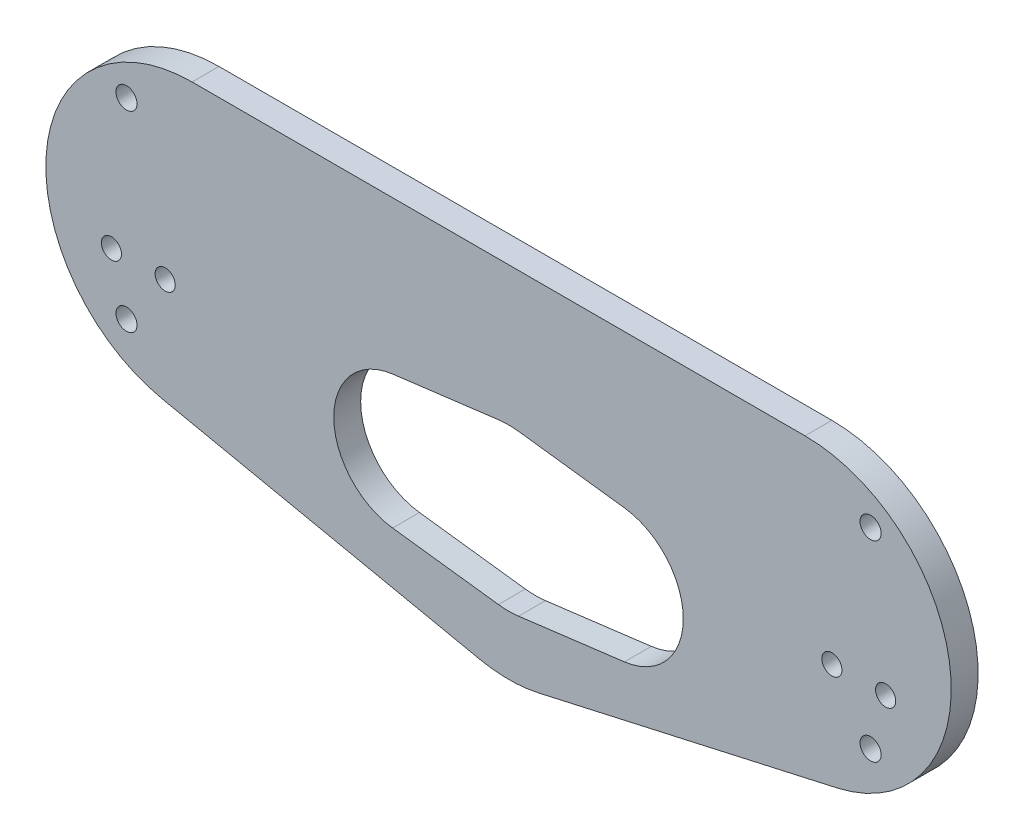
SolidWorks part; units mm, degrees
ref_plane "Front Plane" through (0, 0, 0) normal (0, 0, 1) x (1, 0, 0)
ref_plane "Top Plane" through (0, 0, 0) normal (0, 1, 0) x (1, 0, 0)
ref_plane "Right Plane" through (0, 0, 0) normal (1, 0, 0) x (0, 0, -1)
sketch "Sketch1" plane through (0, 0, 0) normal (0, 0, 1) x (1, 0, 0)
  line L3 (66.04, 34.544) -> (-78.74, 34.544)
  line L4 (-85.8469, -33.805) -> (-10.7844, -49.5856)
  line L5 (3.2368, -49.4912) -> (73.6014, -33.7063)
  line L6 (66.04, 34.544) -> (-78.74, 34.544)
  line L7 (-85.8469, -33.805) -> (-10.7844, -49.5856)
  line L8 (3.2368, -49.4912) -> (73.6014, -33.7063)
  circle A0 centre (-94.234, -21.721) radius 2.4892 construction
  circle A1 centre (-97.79, -9.021) radius 2.3813 construction
  circle A2 centre (-85.09, -9.021) radius 2.3813 construction
  arc A3 (73.6014, -33.7063) -> (66.04, 34.544) centre (66.04, 0) ccw
  arc A4 (-78.74, 34.544) -> (-85.8469, -33.805) centre (-78.74, 0) ccw
  arc A5 (-10.7844, -49.5856) -> (3.2368, -49.4912) centre (-3.991, -17.272) ccw
  arc A6 (73.6014, -33.7063) -> (66.04, 34.544) centre (66.04, 0) ccw
  arc A7 (-78.74, 34.544) -> (-85.8469, -33.805) centre (-78.74, 0) ccw
  arc A8 (-10.7844, -49.5856) -> (3.2368, -49.4912) centre (-3.991, -17.272) ccw
  circle A9 centre (-94.234, 23.555) radius 2.4892 construction
  circle A10 centre (81.534, 23.555) radius 2.4892 construction
  circle A11 centre (72.39, -9.021) radius 2.3813 construction
  circle A12 centre (85.09, -9.021) radius 2.3813 construction
  circle A13 centre (81.534, -21.721) radius 2.4892 construction
  circle A14 centre (-94.234, -21.721) radius 2.4892
  circle A15 centre (-97.79, -9.021) radius 2.3813
  circle A16 centre (-85.09, -9.021) radius 2.3813
  circle A17 centre (-94.234, 23.555) radius 2.4892
  circle A18 centre (81.534, 23.555) radius 2.4892
  circle A19 centre (72.39, -9.021) radius 2.3813
  circle A20 centre (85.09, -9.021) radius 2.3813
  circle A21 centre (81.534, -21.721) radius 2.4892
  dimension "D1" = 0
extrude "Boss-Extrude1" add sketch "Sketch1" against normal blind 6.35
sketch "Sketch2" plane through (0, 0, 0) normal (0, 0, 1) x (1, 0, 0)
  line L0 (-1.6097, 1.6286) -> (23.3934, -1.5215)
  line L1 (23.3934, -33.0225) -> (-1.6097, -36.1726)
  line L2 (-31.3754, -1.5215) -> (-6.3722, 1.6286)
  line L3 (-31.3754, -33.0225) -> (-6.3722, -36.1726)
  arc A0 (-10.7844, -49.5856) -> (3.2368, -49.4912) centre (-3.991, -17.272) ccw construction
  arc A1 (-10.7844, -49.5856) -> (3.2368, -49.4912) centre (-3.991, -17.272) ccw
  arc A2 (-1.6097, 1.6286) -> (-6.3722, 1.6286) centre (-3.991, -17.272) ccw
  arc A3 (-31.3754, -1.5215) -> (-31.3754, -33.0225) centre (-29.391, -17.272) ccw
  arc A4 (23.3934, -33.0225) -> (23.3934, -1.5215) centre (21.409, -17.272) ccw
  arc A5 (-6.3722, -36.1726) -> (-1.6097, -36.1726) centre (-3.991, -17.272) ccw
  dimension "D1" = 38.1
  dimension "D2" = 31.75
  dimension "D3" = 25.4
  dimension "D4" = 25.4
extrude "Cut-Extrude1" cut sketch "Sketch2" against normal through all contours A2
sketch "Sketch3" plane through (0, 0, -6.35) normal (0, 0, -1) x (-1, 0, 0)
  line L0 (-97.8055, -2.671) -> (-68.0735, -2.671)
  line L1 (-67.2368, -12.7313) -> (-82.539, -33.9845)
  line L2 (6.35, 29.7815) -> (6.35, 20.3057) construction
  line L3 (80.4917, 1.181) -> (28.3091, 3.665)
  line L4 (92.1003, 24.6121) -> (80.4917, 1.181)
  line L5 (83.3764, -3.7242) -> (40.0892, -1.6637)
  line L6 (-72.5589, -29.0593) -> (-2.1943, -44.8442)
  line L7 (9.8045, -44.925) -> (84.8671, -29.1444)
  line L8 (78.74, 29.7815) -> (-66.04, 29.7815)
  line L9 (-72.5589, -29.0593) -> (-2.1943, -44.8442)
  line L10 (9.8045, -44.925) -> (84.8671, -29.1444)
  line L11 (78.74, 29.7815) -> (-66.04, 29.7815)
  line L12 (96.3677, 22.4979) -> (83.3764, -3.7242)
  line L13 (81.934, -1.2716) -> (37.3471, 0.8508)
  line L14 (94.234, 23.555) -> (81.934, -1.2716)
  line L15 (79.9368, -12.7313) -> (95.239, -33.9845)
  line L16 (110.5055, -2.671) -> (80.7735, -2.671)
  line L17 (-69.234, -1.2716) -> (-33.7862, 0.4158) construction
  line L18 (-81.534, 23.555) -> (-69.234, -1.2716)
  line L19 (-69.234, -1.2716) -> (-24.6471, 0.8508)
  line L20 (-83.6677, 22.4979) -> (-70.6764, -3.7242)
  line L21 (-23.9887, -37.7476) -> (1.0144, -40.8977)
  line L22 (6.9675, -40.8977) -> (31.9707, -37.7476)
  line L23 (31.9707, 3.2036) -> (6.9675, 6.3537)
  line L24 (1.0144, 6.3537) -> (-23.9887, 3.2036)
  line L25 (-23.9887, -37.7476) -> (1.0144, -40.8977)
  line L26 (6.9675, -40.8977) -> (31.9707, -37.7476)
  line L27 (31.9707, 3.2036) -> (6.9675, 6.3537)
  line L28 (1.0144, 6.3537) -> (-23.9887, 3.2036)
  line L29 (-70.6764, -3.7242) -> (-27.3892, -1.6637)
  line L30 (-79.4003, 24.6121) -> (-67.7917, 1.181)
  line L31 (-67.7917, 1.181) -> (-15.6091, 3.665)
  line L32 (-67.7917, 1.181) -> (-33.8995, 2.7943) construction
  line L33 (-70.6764, -3.7242) -> (-33.673, -1.9628) construction
  circle A0 centre (-81.534, -21.721) radius 6.35
  arc A1 (36.6887, 3.2036) -> (36.6887, -37.7476) centre (34.109, -17.272) cw
  circle A2 centre (97.79, -9.021) radius 6.35
  circle A3 centre (94.234, 23.555) radius 6.35
  circle A4 centre (85.09, -9.021) radius 6.35
  arc A5 (60.0293, -34.7191) -> (52.8675, -25.8757) centre (58.6394, -28.523) cw
  arc A6 (-66.04, 29.7815) -> (-72.5589, -29.0593) centre (-66.04, 0) ccw
  arc A7 (-2.1943, -44.8442) -> (9.8045, -44.925) centre (3.991, -17.272) ccw
  arc A8 (84.8671, -29.1444) -> (78.74, 29.7815) centre (78.74, 0) ccw
  arc A9 (-66.04, 29.7815) -> (-72.5589, -29.0593) centre (-66.04, 0) ccw
  arc A10 (-2.1943, -44.8442) -> (9.8045, -44.925) centre (3.991, -17.272) ccw
  arc A11 (84.8671, -29.1444) -> (78.74, 29.7815) centre (78.74, 0) ccw
  arc A12 (78.74, 29.7815) -> (85.2589, -29.0593) centre (78.74, 0) cw
  circle A13 centre (94.234, -21.721) radius 6.35
  arc A18 (-47.3293, -34.7191) -> (-40.1675, -25.8757) centre (-45.9394, -28.523) ccw
  circle A19 centre (-72.39, -9.021) radius 6.35
  circle A20 centre (-81.534, 23.555) radius 6.35
  circle A21 centre (-85.09, -9.021) radius 6.35
  arc A22 (1.0144, -40.8977) -> (6.9675, -40.8977) centre (3.991, -17.272) ccw
  arc A23 (31.9707, -37.7476) -> (31.9707, 3.2036) centre (29.391, -17.272) ccw
  arc A24 (6.9675, 6.3537) -> (1.0144, 6.3537) centre (3.991, -17.272) ccw
  arc A25 (-23.9887, 3.2036) -> (-23.9887, -37.7476) centre (-21.409, -17.272) ccw
  arc A26 (1.0144, -40.8977) -> (6.9675, -40.8977) centre (3.991, -17.272) ccw
  arc A27 (31.9707, -37.7476) -> (31.9707, 3.2036) centre (29.391, -17.272) ccw
  arc A28 (6.9675, 6.3537) -> (1.0144, 6.3537) centre (3.991, -17.272) ccw
  arc A29 (-23.9887, 3.2036) -> (-23.9887, -37.7476) centre (-21.409, -17.272) ccw
  dimension "D3" = 12.7
  dimension "D4" = 12.7
  dimension "D5" = 12.7
  dimension "D1" = 4.7625
  dimension "D2" = 4.7625
  dimension "D6" = 2.3813
  dimension "D7" = 2.3813
extrude "Cut-Extrude2" cut sketch "Sketch3" against normal blind 4.7625 contours A28 L27 L3 L4 A3 A11 L11 A9 A20 L30 L31 L28 | L10 A11 L15 A4 L5 A1 A5 | L16 A11 A3 L12 | A29 L29 A19 L1 A9 L9 A18 | A20 A9 L0 L20
fillet "Fillet1" radius 3.81 23 edges at (87.2876, 20.8681, -3.9688) (95.7015, -2.671, -3.9688) (71.1982, -2.671, -3.9688) (81.0544, 17.2231, -3.9688) (-108.4015, -2.671, -3.9688) (-93.7544, 17.2231, -3.9688) (-83.8982, -2.671, -3.9688) (35.3357, -2.042, -3.9688) (69.0106, -3.6449, -3.9688) (77.7773, -27.371, -3.9688) (-99.9876, 20.8681, -3.9688) (-90.4773, -27.371, -3.9688) (-48.0357, -2.042, -3.9688) (-57.8515, -34.824, -3.9688) (-81.7106, -3.6449, -3.9688) (-28.3091, 3.665, -3.9688) (-80.4917, 1.181, -3.9688) (-89.487, 19.3374, -3.9688) (-89.4884, 27.7742, -3.9688) (76.787, 19.3374, -3.9688) (67.7917, 1.181, -3.9688) (23.1922, 3.304, -3.9688) (76.7884, 27.7742, -3.9688)
